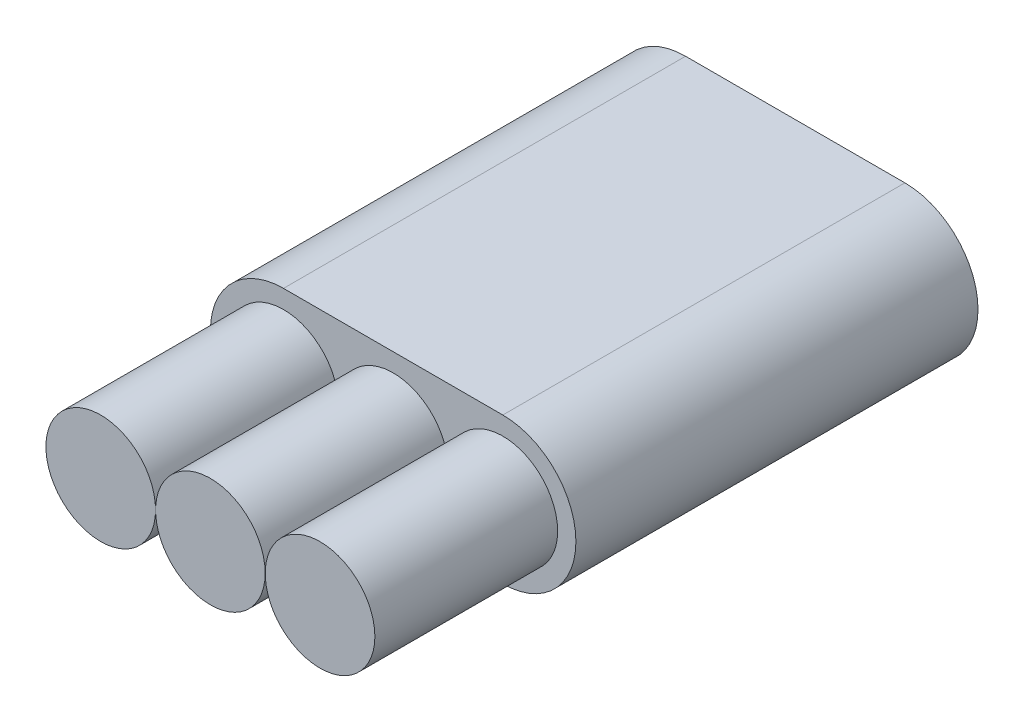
SolidWorks part; units mm, degrees
ref_plane "Front Plane" through (0, 0, 0) normal (0, 0, 1) x (1, 0, 0)
ref_plane "Top Plane" through (0, 0, 0) normal (0, 1, 0) x (1, 0, 0)
ref_plane "Right Plane" through (0, 0, 0) normal (1, 0, 0) x (0, 0, -1)
sketch "Sketch1" plane through (0, 0, 0) normal (0, 0, 1) x (1, 0, 0)
  line L0 (1.5, -0.5) -> (7.5, -0.5)
  line L1 (1.5, 0) -> (7.5, 0) construction
  line L2 (1.5, 3.5) -> (7.5, 3.5)
  line L3 (1.5, 3) -> (7.5, 3) construction
  arc A0 (1.5, 3) -> (1.5, 0) centre (1.5, 1.5) ccw construction
  arc A1 (7.5, 3) -> (7.5, 0) centre (7.5, 1.5) cw construction
  arc A2 (7.5, 3.5) -> (7.5, -0.5) centre (7.5, 1.5) cw
  arc A3 (1.5, 3.5) -> (1.5, -0.5) centre (1.5, 1.5) ccw
  dimension "D1" = 0.5
extrude "Boss-Extrude1" add sketch "Sketch1" along normal blind 11
sketch "Sketch2" plane through (0, 0, 11) normal (0, 0, 1) x (1, 0, 0)
  line L0 (1.5, 1.5) -> (7.5, 1.5) construction
  circle A0 centre (1.5, 1.5) radius 1.5
  circle A1 centre (7.5, 1.5) radius 1.5
  circle A2 centre (4.5, 1.5) radius 1.499
extrude "Boss-Extrude5" add sketch "Sketch2" along normal blind 5 contours A0 | A1 | A2
